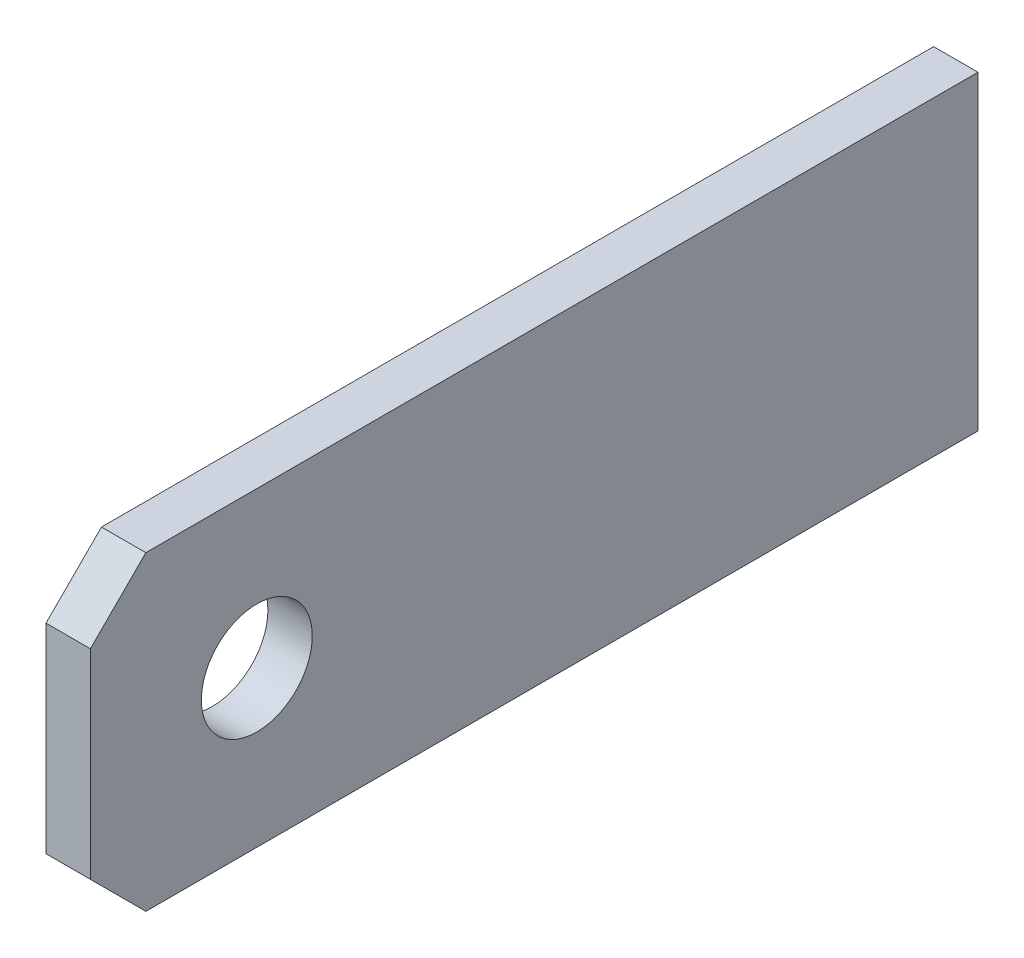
SolidWorks part; units mm, degrees
ref_plane "FACE" through (0, 0, 0) normal (0, 0, 1) x (1, 0, 0)
ref_plane "DESSUS" through (0, 0, 0) normal (0, 1, 0) x (1, 0, 0)
ref_plane "GAUCHE" through (0, 0, 0) normal (1, 0, 0) x (0, 0, -1)
sketch "Esquisse1" plane through (0, 0, 0) normal (0, 0, 1) x (1, 0, 0)
  line L0 (-11.7, -1.4) -> (-11.3, -1.4) construction
  line L1 (-11.7, 1.4) -> (-11.7, -1.4) construction
  line L2 (-11.3, 1.4) -> (-11.7, 1.4) construction
  line L3 (-11.3, -1.4) -> (-11.3, 1.4) construction
  line L4 (-11.7, -1.4) -> (-11.3, -1.4)
  line L5 (-11.7, 1.4) -> (-11.7, -1.4)
  line L6 (-11.3, 1.4) -> (-11.7, 1.4)
  line L7 (-11.3, -1.4) -> (-11.3, 1.4)
extrude "Base-Extrusion" add sketch "Esquisse1" along normal blind 8
chamfer "Chanfrein1" distance 0.5 angle 45
sketch "Esquisse2" plane through (-11.7, 0, 0) normal (-1, 0, 0) x (0, 0, 1)
  line L0 (8, 0.9) -> (8, -0.9) construction
  line L1 (7.5, -1.4) -> (0, -1.4) construction
  circle A0 centre (6.5, 0) radius 0.5
  dimension "D1" = 1
  dimension "D2" = 1.5
  dimension "D3" = 1.4
extrude "Enlèv. mat.-Extru.1" cut sketch "Esquisse2" against normal through all
